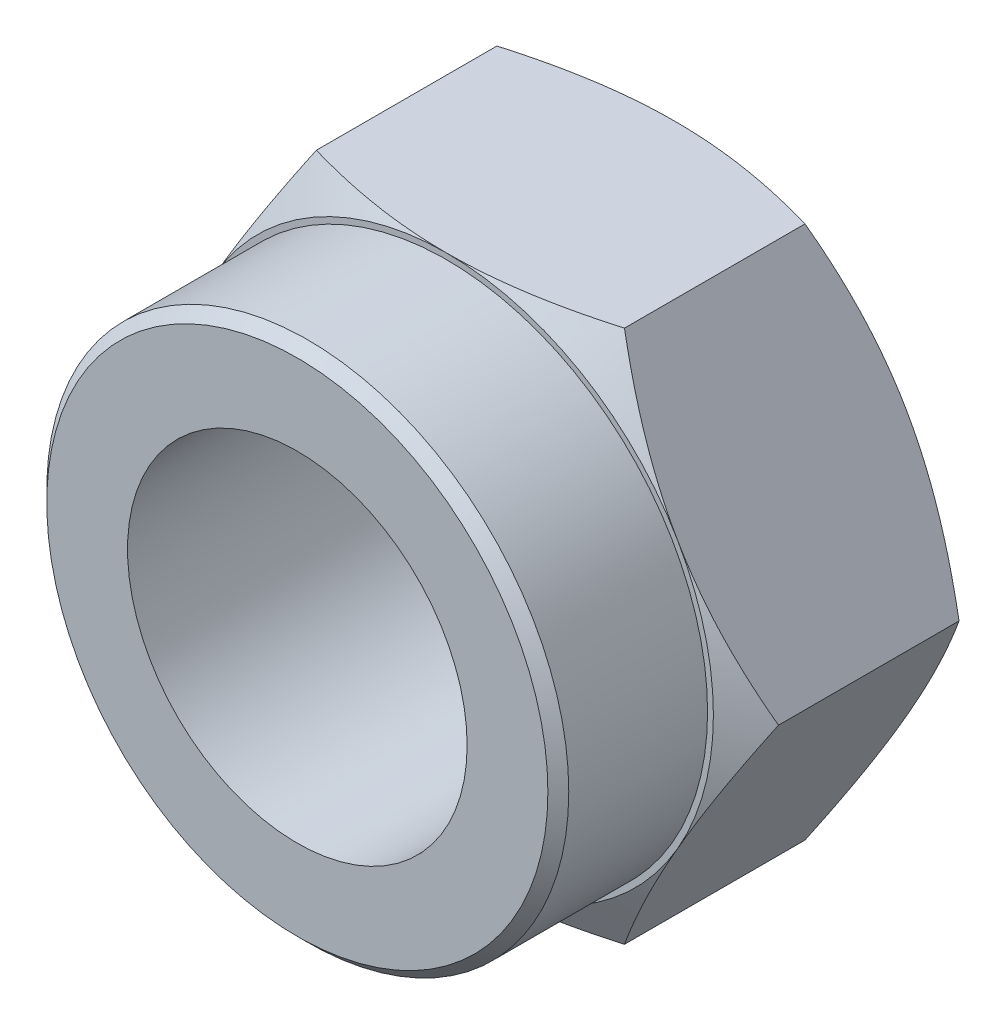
SolidWorks part; units mm, degrees
ref_plane "Front" through (0, 0, 0) normal (0, 0, 1) x (1, 0, 0)
ref_plane "Top" through (0, 0, 0) normal (0, 1, 0) x (1, 0, 0)
ref_plane "Right" through (0, 0, 0) normal (1, 0, 0) x (0, 0, -1)
sketch "Sketch1" plane through (0, 0, 0) normal (0, 0, 1) x (1, 0, 0)
  line L1 (15.8771, -27.5) -> (31.7543, 0)
  line L2 (31.7543, 0) -> (15.8771, 27.5)
  line L3 (15.8771, 27.5) -> (-15.8771, 27.5)
  line L4 (-15.8771, 27.5) -> (-31.7543, 0)
  line L5 (-31.7543, 0) -> (-15.8771, -27.5)
  line L6 (-15.8771, -27.5) -> (15.8771, -27.5)
  circle A0 centre (0, 0) radius 27.5 construction
  circle A1 centre (0, 0) radius 17.5
  dimension "xd" = 35
  dimension "s" = 55
extrude "BaseNut" add sketch "Sketch1" against normal blind 23.52
sketch "Sketch3" plane through (0, 0, 0) normal (0, 1, 0) x (1, 0, 0)
  line L0 (0, 16.3108) -> (0, -16.1137) construction
  line L2 (-2.0696, 11.76) -> (33.5085, 11.76) construction
  line L3 (27.5, 23.52) -> (31.7543, 23.52)
  line L5 (31.7543, 23.52) -> (31.7543, 21.0638)
  line L7 (31.7543, 21.0638) -> (27.5, 23.52)
  line L8 (31.7543, 2.4562) -> (27.5, 0)
  line L9 (31.7543, 0) -> (31.7543, 2.4562)
  line L10 (27.5, 0) -> (31.7543, 0)
  dimension "D1" = 30
  dimension "s1" = 55
revolve "Double-Chamfer" cut sketch "Sketch3" angle 360 about L0
sketch "Sketch2" plane through (19.1814, 9.5168, 0) normal (0, 0, 1) x (1, 0, 0)
  circle A1 centre (-19.1814, -9.5168) radius 17.5 construction
  circle A2 centre (-19.1814, -9.5168) radius 26.9
  circle A3 centre (-19.1814, -9.5168) radius 17.5
  dimension "s1" = 53.8
extrude "Extrude1" add sketch "Sketch2" along normal offset from surface (15.38 mm away) 38.9
sketch "Sketch5" plane through (0, 0, 0) normal (0, 1, 0) x (1, 0, 0)
  line L0 (0, 16.8008) -> (0, -2.8116) construction
  line L2 (17.5, 23.52) -> (19.45, 23.52)
  line L5 (19.45, 23.52) -> (17.5, 22.3942)
  line L7 (17.5, 22.3942) -> (17.5, 23.52)
  dimension "D1" = 30
  dimension "da" = 38.9
revolve "EndChamfer" cut sketch "Sketch5" angle 360 about L0
chamfer "Chamfer1" distance 1.076 angle 45 1 edges at (26.9, 0, 15.38)
sketch "Sketch6" plane through (0, 0, 0) normal (0, 1, 0) x (1, 0, 0)
  line L0 (0, -21.8676) -> (0, 36.2739) construction
  line L1 (-17.933, 22.3942) -> (-17.5, 22.1442)
  line L2 (-17.5, 22.1442) -> (-17, 22.1442)
  line L3 (-17, 22.1442) -> (-17, 22.6442)
  line L4 (-17, 22.6442) -> (-17.5, 22.6442)
  line L5 (-17.5, 22.6442) -> (-17.933, 22.3942)
  dimension "D1" = 0.5
  dimension "D2" = 35
revolve "Cut-Revolve10" [suppressed] cut sketch "Sketch6" angle 360 about L0
pattern_linear "LPattern10" [suppressed] count 39 spacing 0.6 along (0, 0, -1)
equation "\"D1@Chamfer1\" = \"s1@Sketch2\" / 50"
equation "\"s1@Sketch3\" = \"s@Sketch1\""
equation "\"D2@Sketch6\" = \"xd@Sketch1\""
equation "\"D1@Sketch6\" =  ( \"D2@ThreadCosmetic1\"  - \"xd@Sketch1\")  / 2"
equation "\"D3@LPattern10\" = \"D1@Sketch6\" * 1.2"
equation "\"D1@LPattern10\" = \"m@BaseNut\" / \"D3@LPattern10\""
